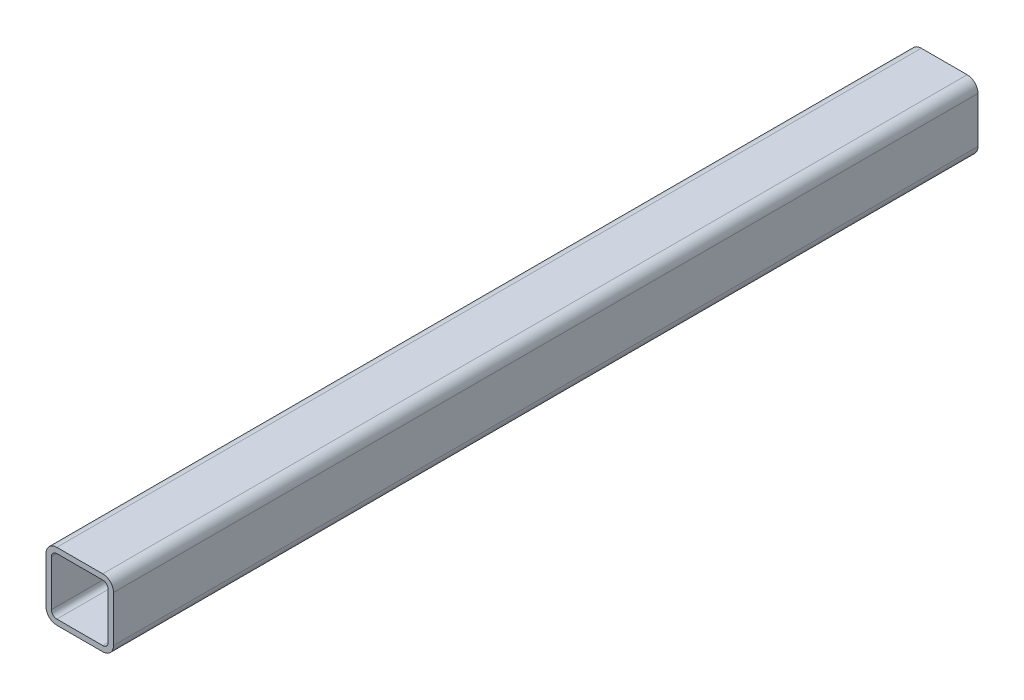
SolidWorks part; units mm, degrees
ref_plane "Plan_Face" through (0, 0, 0) normal (0, 0, 1) x (1, 0, 0)
ref_plane "Plan_Dessus" through (0, 0, 0) normal (0, 1, 0) x (1, 0, 0)
ref_plane "Plan_Droite" through (0, 0, 0) normal (1, 0, 0) x (0, 0, -1)
sketch "Esquisse1" plane through (0, 0, 0) normal (0, 0, 1) x (1, 0, 0)
  line L1 (-12.5, 12.5) -> (12.5, 12.5)
  line L2 (-12.5, 12.5) -> (-12.5, -12.5)
  line L3 (-12.5, -12.5) -> (12.5, -12.5)
  line L4 (12.5, 12.5) -> (12.5, -12.5)
  line L5 (-12.5, 12.5) -> (12.5, -12.5) construction
  line L6 (-12.5, -12.5) -> (12.5, 12.5) construction
  point P0 (0, 0)
  dimension "D1" = 25
extrude "Extru.-Mince1" add sketch "Esquisse1" along normal mid plane 320 thin
fillet "Congé1" radius 2 4 edges at (10.5, -10.5, 0) (-10.5, 10.5, 0) (10.5, 10.5, 0) (-10.5, -10.5, 0)
fillet "Congé2" radius 4 4 edges at (12.5, -12.5, 0) (-12.5, -12.5, 0) (12.5, 12.5, 0) (-12.5, 12.5, 0)
